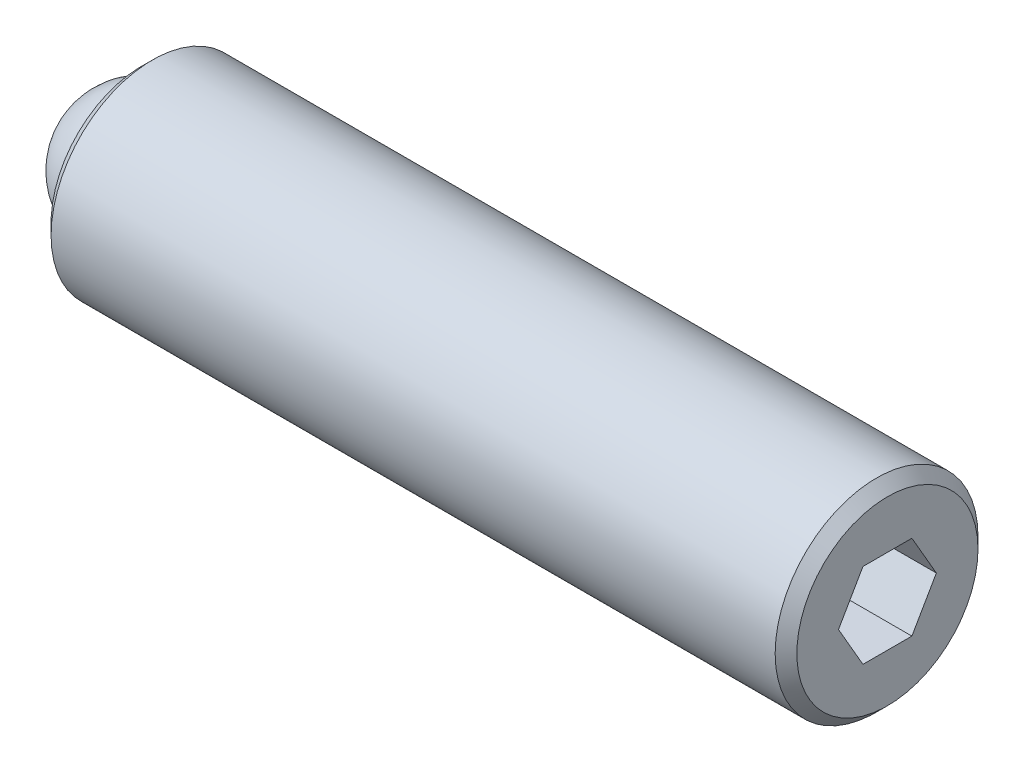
SolidWorks part; units mm, degrees
ref_plane "Front Plane" through (0, 0, 0) normal (0, 0, 1) x (1, 0, 0)
ref_plane "Top Plane" through (0, 0, 0) normal (0, 1, 0) x (1, 0, 0)
ref_plane "Right Plane" through (0, 0, 0) normal (1, 0, 0) x (0, 0, -1)
sketch "Sketch2" plane through (0, 0, 0) normal (1, 0, 0) x (0, 0, -1)
  circle A0 centre (0, 0) radius 2.3749
  dimension "D1" = 4.7498
extrude "Boss-Extrude1" add sketch "Sketch2" along normal blind 17.4625
sketch "Sketch3" plane through (0, 0, 0) normal (-1, 0, 0) x (0, 0, 1)
  circle A0 centre (0, 0) radius 1.5875
  dimension "D1" = 3.175
chamfer "Chamfer1" distance 0.254 angle 45 1 edges at (0, 0, -2.3749)
chamfer "Chamfer2" distance 0.254 angle 45 1 edges at (17.4625, 0, -2.3749)
sketch "Sketch4" plane through (17.4625, 0, 0) normal (1, 0, 0) x (0, 0, -1)
  line L1 (1.1457, 0) -> (0.5728, 0.9922)
  line L2 (0.5728, 0.9922) -> (-0.5728, 0.9922)
  line L3 (-0.5728, 0.9922) -> (-1.1457, 0)
  line L4 (-1.1457, 0) -> (-0.5728, -0.9922)
  line L5 (-0.5728, -0.9922) -> (0.5728, -0.9922)
  line L6 (0.5728, -0.9922) -> (1.1457, 0)
  circle A0 centre (0, 0) radius 0.9922 construction
extrude "Cut-Extrude2" cut sketch "Sketch4" against normal blind 2.286
extrude "Cut-Extrude3" cut sketch "Sketch3" against normal blind 1.5875
sketch "Sketch5" plane through (0, 0, 0) normal (-1, 0, 0) x (0, 0, 1)
  line L0 (0, 0) -> (0, -1.5875)
  line L1 (0, 0) -> (0, 1.5875)
  arc A0 (0, 1.5875) -> (0, -1.5875) centre (0, 0) ccw
revolve "Revolve1" add sketch "Sketch5" angle 360 about L1
